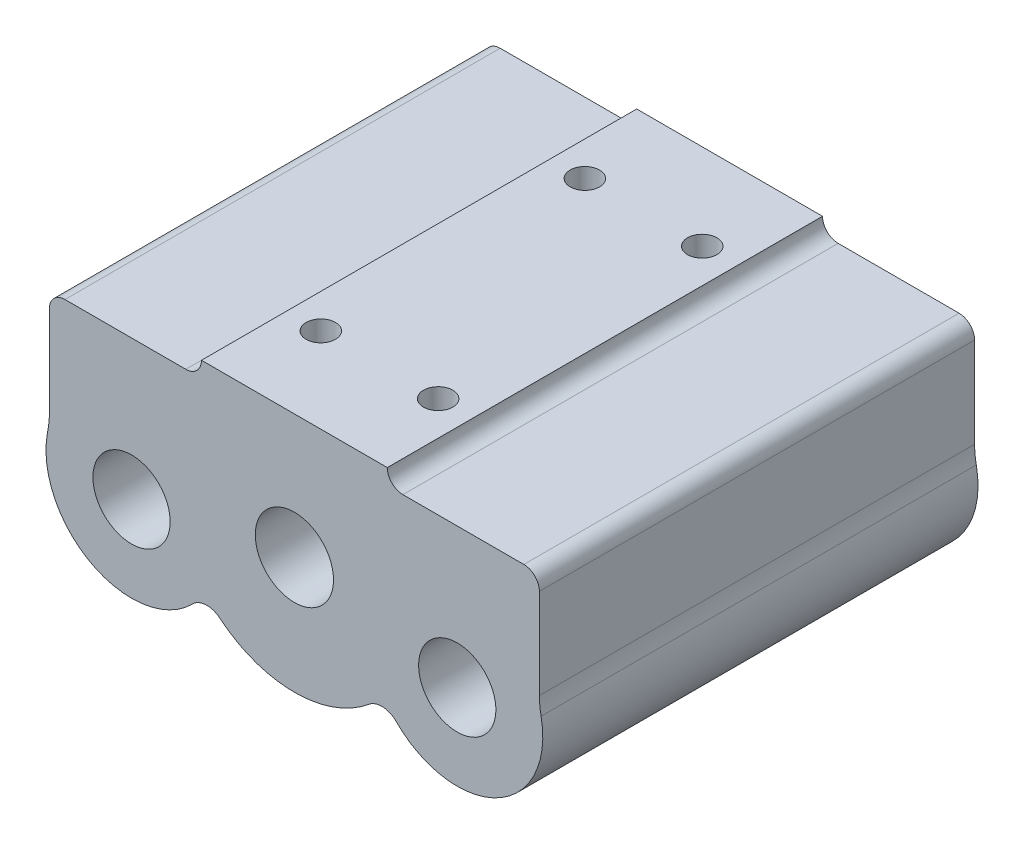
SolidWorks part; units mm, degrees
ref_plane "Front" through (0, 0, 0) normal (0, 0, 1) x (1, 0, 0)
ref_plane "Top" through (0, 0, 0) normal (0, 1, 0) x (1, 0, 0)
ref_plane "Right" through (0, 0, 0) normal (1, 0, 0) x (0, 0, -1)
ref_plane "Plane4" through (0, 0, 0) normal (0, 0, 1) x (-1, 0, 0)
sketch "Sketch1" plane through (0, 0, -414.0505) normal (0, 0, 1) x (-1, 0, 0)
  line L1 (0, 0) -> (0, -37.2448) construction
  line L3 (25.0349, -0.2825) -> (25.0349, -9.5125)
  line L4 (-25.0651, -0.2825) -> (-25.0651, -9.5125)
  line L5 (-23.4776, -11.1) -> (-11.1151, -11.1)
  line L6 (-9.5151, -12.7) -> (9.4849, -12.7)
  line L7 (23.4474, -11.1) -> (11.0849, -11.1)
  arc A0 (25.0349, -0.2825) -> (25.2099, 1.4588) centre (33.7849, -0.2825) cw
  arc A1 (25.2099, 1.4588) -> (10.4, 9.3391) centre (16.6349, 3.2) ccw
  arc A4 (10.4, 9.3391) -> (7.6131, 9.1985) centre (8.93, 10.7865) cw
  arc A5 (7.6131, 9.1985) -> (-7.6433, 9.1985) centre (-0.0151, 0) ccw
  arc A6 (-7.6433, 9.1985) -> (-10.4303, 9.3391) centre (-8.9602, 10.7865) cw
  arc A7 (-10.4303, 9.3391) -> (-25.2401, 1.4588) centre (-16.6651, 3.2) ccw
  arc A8 (-25.2401, 1.4588) -> (-25.0651, -0.2825) centre (-33.8151, -0.2825) cw
  arc A9 (-25.0651, -9.5125) -> (-23.4776, -11.1) centre (-23.4776, -9.5125) ccw
  arc A10 (-11.1151, -11.1) -> (-9.5151, -12.7) centre (-11.1151, -12.7) cw
  arc A11 (25.0349, -9.5125) -> (23.4474, -11.1) centre (23.4474, -9.5125) cw
  arc A12 (11.0849, -11.1) -> (9.4849, -12.7) centre (11.0849, -12.7) ccw
extrude "Base-Extrude" add sketch "Sketch1" along normal up to surface (44.502 mm away)
ref_plane "Plane5" through (0, 0, -436.3005) normal (0, 0, 1) x (1, 0, 0)
sketch "Sketch4" plane through (0, 0, -436.3005) normal (0, 0, 1) x (1, 0, 0)
  circle A1 centre (0.0151, 0) radius 4
  circle A2 centre (0.0151, 0) radius 4 construction
extrude "Cut-Extrude5" cut sketch "Sketch4" against normal through all and the other way through all
sketch "Sketch2" plane through (0, 0, -458.5525) normal (0, 0, -1) x (-1, 0, 0)
  line L0 (20.5849, -3.2982) -> (20.5849, -16.0512) construction
  circle A0 centre (16.6349, -3.2) radius 3.95
  circle A1 centre (-16.6651, -3.2) radius 3.95
extrude "Cut-Extrude4" cut sketch "Sketch2" against normal through all
hole_wizard "M3X0.5 Tapped Hole1" positions "Sketch10" profile "Sketch9" tap size "M3x0.5" standard "Ansi Metric"
sketch "Sketch10" plane through (0, 12.7, 0) normal (0, 1, 0) x (-1, 0, 0)
  point P0 (5.9849, -422.7505)
  point P1 (5.9849, -449.7505)
  point P2 (-6.0151, -449.7505)
  point P3 (-6.0151, -422.7505)
sketch "Sketch9" plane through (-5.9849, 12.7, -422.7505) normal (1, 0, 0) x (0, 0, 1)
  line L0 (0, 0) -> (0, 9.2511)
  line L1 (0, 9.2511) -> (1.25, 8.5)
  line L2 (1.25, 8.5) -> (1.25, 6)
  line L3 (1.25, 6) -> (1.5, 6)
  line L4 (1.5, 6) -> (1.5, 0)
  line L5 (1.5, 0) -> (0, 0)
  line L10 (0, 9.2511) -> (-1.25, 8.5) construction
  line L11 (0, -6.35) -> (0, 107.95) construction
  dimension "Tap Drill Dia." = 2.5
  dimension "Tap Drill Depth" = 8.5
  dimension "Thread Dia." = 3
  dimension "Thread Depth" = 6
  dimension "Drill Angle" = 118
sketch "Sketch11" plane through (0, 0, 0) normal (0, 1, 0) x (1, 0, 0)
  line L0 (-12.816, 436.3005) -> (10.3426, 436.3005)
  line L1 (-13.5575, 436.3005) -> (13.5575, 436.3005) construction
